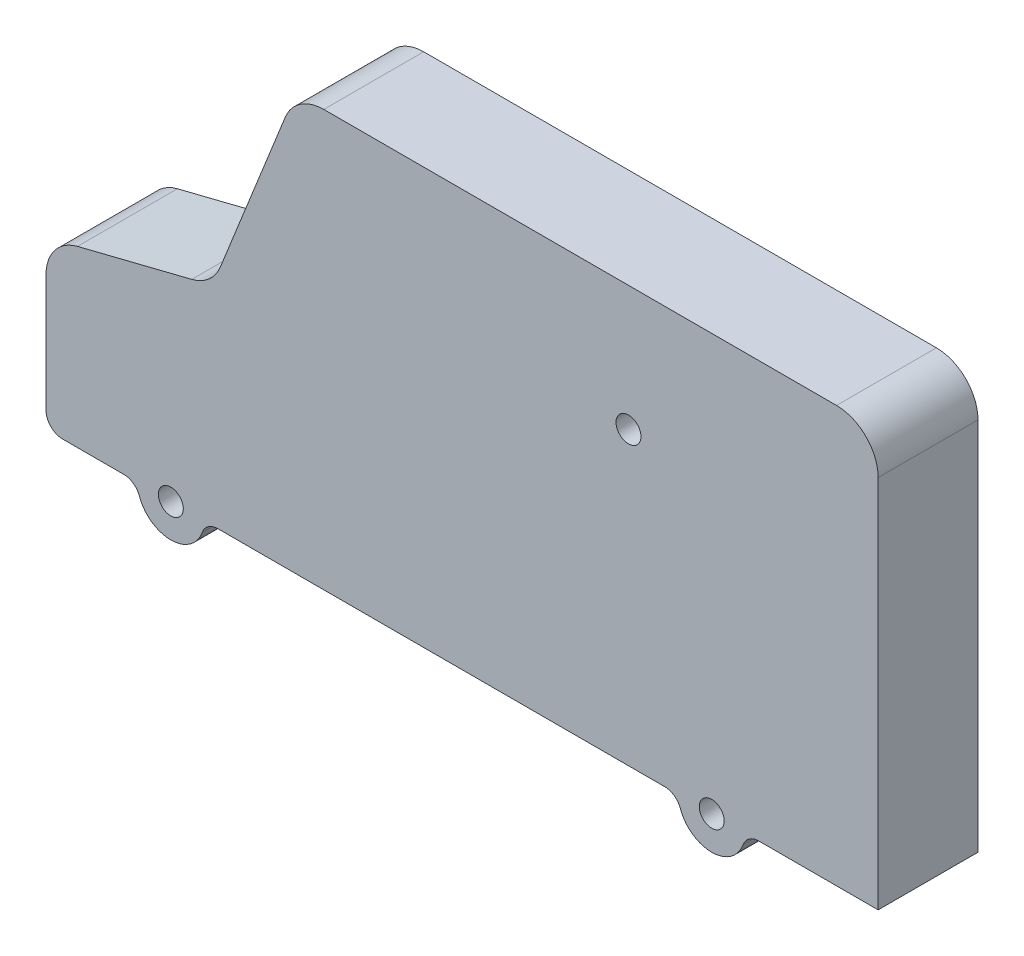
SolidWorks part; units mm, degrees
ref_plane "Plan de face" through (0, 0, 0) normal (0, 0, 1) x (1, 0, 0)
ref_plane "Plan de dessus" through (0, 0, 0) normal (0, 1, 0) x (1, 0, 0)
ref_plane "Plan de droite" through (0, 0, 0) normal (1, 0, 0) x (0, 0, -1)
sketch "Esquisse1" plane through (0, 0, 0) normal (0, 0, 1) x (1, 0, 0)
  line L0 (3.7873, 20.9468) -> (17.5198, 24.3799)
  line L1 (2, 0) -> (9.3431, 0)
  line L2 (0, 2) -> (0, 16.0961)
  line L3 (33.3852, 50) -> (95, 50)
  line L4 (100, 0) -> (100, 45)
  line L5 (20.9495, 27.3737) -> (28.7428, 46.857)
  line L6 (20.6569, 0) -> (74.3431, 0)
  line L7 (85.6569, 0) -> (100, 0)
  circle A0 centre (15, 0) radius 1.5
  circle A1 centre (80, 0) radius 1.5
  arc A2 (11.2288, -1.3333) -> (18.7712, -1.3333) centre (15, 0) ccw
  arc A3 (76.2288, -1.3333) -> (83.7712, -1.3333) centre (80, 0) ccw
  arc A4 (95, 50) -> (100, 45) centre (95, 45) cw
  arc A5 (28.7428, 46.857) -> (33.3852, 50) centre (33.3852, 45) cw
  arc A6 (3.7873, 20.9468) -> (0, 16.0961) centre (5, 16.0961) ccw
  arc A7 (17.5198, 24.3799) -> (20.9495, 27.3737) centre (16.3071, 29.2307) ccw
  arc A8 (2, 0) -> (0, 2) centre (2, 2) cw
  circle A9 centre (70, 35) radius 1.5
  arc A10 (11.2288, -1.3333) -> (9.3431, 0) centre (9.3431, -2) ccw
  arc A11 (18.7712, -1.3333) -> (20.6569, 0) centre (20.6569, -2) cw
  arc A12 (74.3431, 0) -> (76.2288, -1.3333) centre (74.3431, -2) cw
  arc A13 (85.6569, 0) -> (83.7712, -1.3333) centre (85.6569, -2) ccw
  point P16 (100, 50)
  point P20 (0, 20)
  point P23 (20, 25)
  point P25 (0, 0)
  point P34 (19, 0)
  dimension "D1" = 5
  dimension "D2" = 2
  dimension "D8" = 15
  dimension "D9" = 5
  dimension "D7" = 20
  dimension "D5" = 15
  dimension "D11" = 2
  dimension "D3" = 20
  dimension "D4" = 25
  dimension "D6" = 20
  dimension "D10" = 30
extrude "Extrusion1" add sketch "Esquisse1" along normal blind 12
